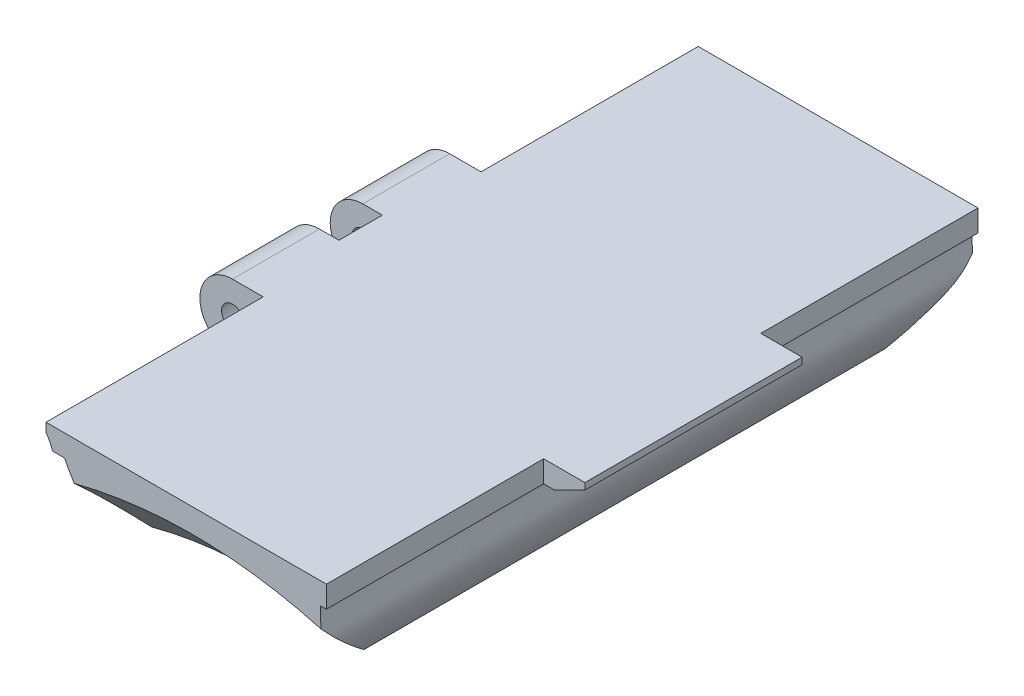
SolidWorks part; units mm, degrees
other "Vaccine_Lid"
ref_plane "Front Plane" through (0, 0, 0) normal (0, 0, 1) x (1, 0, 0)
ref_plane "Top Plane" through (0, 0, 0) normal (0, 1, 0) x (1, 0, 0)
ref_plane "Right Plane" through (0, 0, 0) normal (1, 0, 0) x (0, 0, -1)
imported_body "Imported3"
sketch "Sketch1" plane through (0, 0, -45) normal (0, 0, 1) x (1, 0, 0)
  line L0 (-33.7431, 115) -> (-33.7431, 112.951)
  line L1 (-35.9703, 115) -> (-40.8142, 115)
  line L2 (-29.4744, 110) -> (-33.7431, 110) construction
  line L3 (-32.2431, 110) -> (-33.7431, 110)
  line L4 (-40.8142, 115) -> (30.8142, 115) construction
  line L5 (-35.9703, 115) -> (-33.7431, 115)
  arc A0 (-40.8142, 115) -> (-33.7431, 110) centre (-40.8142, 107.5) ccw
  arc A1 (-33.7431, 112.951) -> (-32.2431, 110) centre (-40.8142, 107.5) cw
  dimension "D1" = 1.5
extrude "Cut-Extrude1" cut sketch "Sketch1" against normal blind 50
sketch "Sketch2" plane through (0, 0, -195) normal (0, 0, -1) x (-1, 0, 0)
  line L0 (40.8142, 115) -> (35.7151, 115)
  line L1 (33.5925, 115) -> (33.5925, 112.9861)
  line L2 (29.4744, 110) -> (33.7431, 110) construction
  line L3 (32.0964, 110) -> (33.7431, 110)
  line L4 (40.8142, 115) -> (-30.8142, 115) construction
  line L5 (33.5925, 115) -> (35.7151, 115)
  arc A1 (33.7431, 110) -> (40.8142, 115) centre (40.8142, 107.5) ccw
  arc A3 (33.5925, 112.9861) -> (32.0964, 110) centre (40.8142, 107.5) ccw
extrude "Cut-Extrude2" cut sketch "Sketch2" against normal blind 50
ref_plane "Plane1" through (0, 0, -125) normal (0, 0, -1) x (-1, 0, 0)
sketch "Sketch3" plane through (0, 0, -125) normal (0, 0, -1) x (-1, 0, 0)
  line L0 (40.8142, 115) -> (36.3142, 115)
  line L1 (36.3142, 115) -> (36.3142, 101.5)
  arc A0 (36.3142, 101.5) -> (40.8142, 115) centre (40.8142, 107.5) ccw
extrude "Cut-Extrude3" cut sketch "Sketch3" against normal blind 10
hole_wizard "Ø5.0 (5) Diameter Hole1" positions "Sketch5" profile "Sketch4" hole size "Ø5.0" standard "ANSI Metric"
sketch "Sketch5" plane through (0, 0, -115) normal (0, 0, -1) x (-1, 0, 0)
  point P0 (40.8142, 107.5)
sketch "Sketch4" plane through (-40.8142, 107.5, -115) normal (1, 0, 0) x (0, 1, 0)
  line L0 (0, 0) -> (0, 70.0392)
  line L1 (0, 70.0392) -> (2.5, 70.0392)
  line L2 (2.5, 70.0392) -> (2.5, 0)
  line L5 (2.5, 0) -> (0, 0)
  line L11 (0, -6.35) -> (0, 107.95) construction
  dimension "Thru Hole Dia." = 5
  dimension "Thru Hole Depth" = 70.0392
hole_wizard "Ø5.0 (5) Diameter Hole2" positions "Sketch7" profile "Sketch6" hole size "Ø5.0" standard "ANSI Metric"
sketch "Sketch7" plane through (0, 0, -125) normal (0, 0, 1) x (1, 0, 0)
  point P0 (-40.8142, 107.5)
sketch "Sketch6" plane through (-40.8142, 107.5, -125) normal (1, 0, 0) x (0, -1, 0)
  line L0 (0, 0) -> (0, 70.0385)
  line L1 (0, 70.0385) -> (2.5, 70.0385)
  line L2 (2.5, 70.0385) -> (2.5, 0)
  line L5 (2.5, 0) -> (0, 0)
  line L11 (0, -6.35) -> (0, 107.95) construction
  dimension "Thru Hole Dia." = 5
  dimension "Thru Hole Depth" = 70.0385
sketch "Sketch8" plane through (0, 0, -95) normal (0, 0, 1) x (1, 0, 0)
